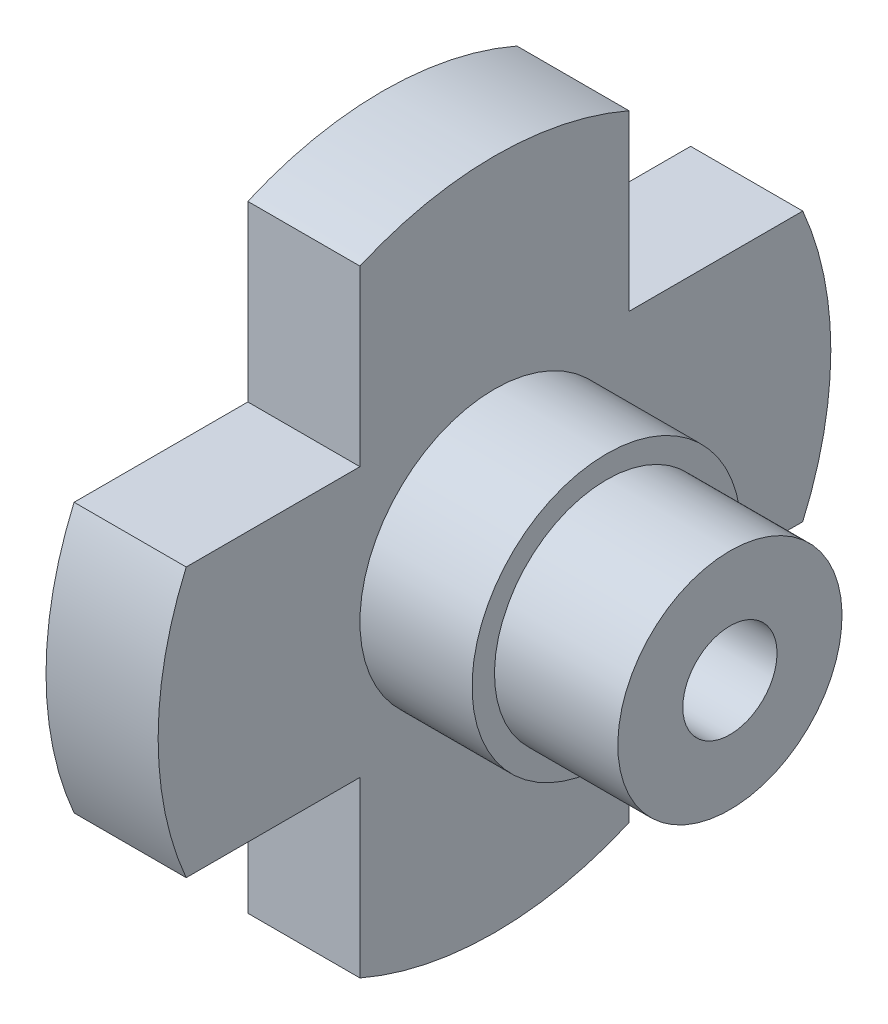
SolidWorks part; units mm, degrees
ref_plane "Front Plane" through (0, 0, 0) normal (0, 0, 1) x (1, 0, 0)
ref_plane "Top Plane" through (0, 0, 0) normal (0, 1, 0) x (1, 0, 0)
ref_plane "Right Plane" through (0, 0, 0) normal (1, 0, 0) x (0, 0, -1)
sketch "Sketch1" plane through (0, 0, 0) normal (0, 0, 1) x (1, 0, 0)
  line L0 (0, 0) -> (-15.5, 0)
  line L1 (-15.5, 0) -> (-15.5, 15)
  line L2 (-15.5, 15) -> (-10.5, 15)
  line L3 (-10.5, 15) -> (-10.5, 6)
  line L4 (-10.5, 6) -> (-5.5, 6)
  line L5 (-5.5, 6) -> (-5.5, 5)
  line L6 (-5.5, 5) -> (0, 5)
  line L7 (0, 5) -> (0, 0)
  dimension "D1" = 5
  dimension "D2" = 6
  dimension "D3" = 15
  dimension "D4" = 5
  dimension "D5" = 10
  dimension "D6" = 15.5
revolve "Revolve1" add sketch "Sketch1" angle 360 about L0
hole_wizard "M5 Tapped Hole1" positions "3DSketch1" profile "Sketch2" tap size "M5" standard "ISO"
sketch3d "3DSketch1"
  line L0 (-15.5, 0, 0) -> (-10.5, 0, 0) construction
  point P0 (-15.5, 0, 0)
sketch "Sketch2" plane through (-15.5, 0, 0) normal (0, 1, 0) x (0, 0, 1)
  line L0 (0, 0) -> (0, 15.5)
  line L1 (0, 15.5) -> (2.1, 15.5)
  line L2 (2.1, 15.5) -> (2.1, 0)
  line L5 (2.1, 0) -> (0, 0)
  line L11 (0, -6.35) -> (0, 107.95) construction
  dimension "Thru Tap Drill Dia." = 4.2
  dimension "Thru Tap Drill Depth" = 15.5
sketch "Sketch3" plane through (-15.5, 0, 0) normal (-1, 0, 0) x (0, 0, 1)
  line L0 (0, 15) -> (0, -15) construction
  line L1 (15, 0) -> (-15, 0) construction
  line L2 (18.1816, 6) -> (-18.7059, 6)
  line L3 (-6, 18.6471) -> (-6, -18.5077)
  line L4 (19.184, -6) -> (-19.04, -6)
  line L5 (6, 18.9144) -> (6, -18.4409)
  line L6 (6, 15) -> (6, -15) construction
  line L7 (15, 6) -> (-15, 6) construction
  line L8 (15, -6) -> (-15, -6) construction
  line L9 (-6, 15) -> (-6, -15) construction
  line L10 (6, 18.9144) -> (18.1816, 6)
  line L11 (19.184, -6) -> (6, -18.4409)
  line L12 (-6, -18.5077) -> (-19.04, -6)
  line L13 (-18.7059, 6) -> (-6, 18.6471)
  circle A0 centre (0, 0) radius 15 construction
  dimension "D1" = 6
  dimension "D2" = 6
extrude "Extrude1" cut sketch "Sketch3" against normal blind 10 contours L10 L5 L2 M2 | L13 L2 L3 M2 | L11 L4 L5 M2 | L12 L3 L4 M2 | L3 L4 M2 | L4 L5 M2 | L5 L2 M2 | L3 L2 M2
